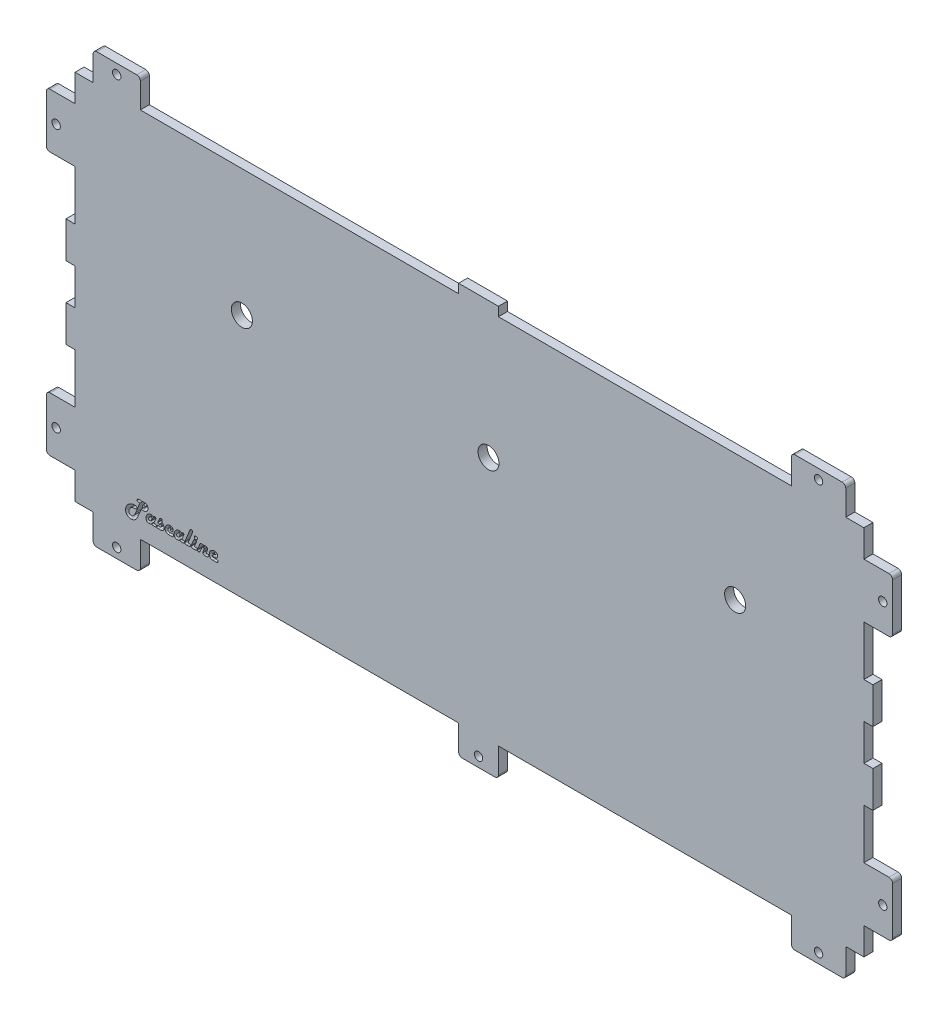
SolidWorks part; units mm, degrees
ref_plane "Front Plane" through (0, 0, 0) normal (0, 0, 1) x (1, 0, 0)
ref_plane "Top Plane" through (0, 0, 0) normal (0, 1, 0) x (1, 0, 0)
ref_plane "Right Plane" through (0, 0, 0) normal (1, 0, 0) x (0, 0, -1)
sketch "Sketch1" plane through (0, 0, 0) normal (0, 0, 1) x (1, 0, 0)
  line L0 (144.78, 85.725) -> (231.14, 85.725) construction
  line L1 (0, 0) -> (276.225, 0)
  line L2 (0, 0) -> (0, 130.175)
  line L3 (0, 130.175) -> (276.225, 130.175)
  line L4 (276.225, 0) -> (276.225, 130.175)
  line L6 (58.42, 85.725) -> (144.78, 85.725) construction
  circle A0 centre (58.42, 85.725) radius 3.683
  circle A1 centre (231.14, 85.725) radius 3.683
  circle A3 centre (144.78, 85.725) radius 3.683
  dimension "D3" = 7.366
  dimension "D1" = 130.175
  dimension "D2" = 45.085
  dimension "D4" = 276.225
  dimension "D5" = 85.725
  dimension "D6" = 86.36
extrude "Boss-Extrude1" add sketch "Sketch1" along normal blind 3.175
sketch "Sketch2" plane through (0, 0, 0) normal (0, 0, 1) x (1, 0, 0)
  line L1 (138.1125, 130.175) -> (138.1125, 0) construction
  line L2 (276.225, 130.175) -> (0, 130.175) construction
  line L3 (0, 0) -> (276.225, 0) construction
  line L4 (286.258, 9.525) -> (286.258, 28.575)
  line L6 (0, 130.175) -> (0, 0) construction
  line L7 (0, 65.0875) -> (276.225, 65.0875) construction
  line L8 (276.225, 0) -> (276.225, 130.175) construction
  line L9 (276.225, 120.65) -> (286.258, 120.65)
  line L10 (276.225, 120.65) -> (276.225, 101.6)
  line L11 (276.225, 101.6) -> (286.258, 101.6)
  line L12 (286.258, 120.65) -> (286.258, 101.6)
  line L13 (276.225, 28.575) -> (286.258, 28.575)
  line L15 (276.225, 9.525) -> (276.225, 28.575)
  line L16 (276.225, 9.525) -> (286.258, 9.525)
  line L17 (-3.175, 84.1375) -> (-3.175, 71.4375)
  line L18 (276.225, 84.1375) -> (279.4, 84.1375)
  line L19 (276.225, 84.1375) -> (276.225, 71.4375)
  line L20 (276.225, 71.4375) -> (279.4, 71.4375)
  line L21 (279.4, 84.1375) -> (279.4, 71.4375)
  line L22 (0, 71.4375) -> (-3.175, 71.4375)
  line L23 (0, 84.1375) -> (0, 71.4375)
  line L24 (0, 84.1375) -> (-3.175, 84.1375)
  line L25 (0, 9.525) -> (-10.033, 9.525)
  line L26 (0, 9.525) -> (0, 28.575)
  line L27 (0, 28.575) -> (-10.033, 28.575)
  line L29 (-10.033, 120.65) -> (-10.033, 101.6)
  line L30 (0, 101.6) -> (-10.033, 101.6)
  line L31 (0, 120.65) -> (0, 101.6)
  line L32 (0, 120.65) -> (-10.033, 120.65)
  line L33 (-10.033, 9.525) -> (-10.033, 28.575)
  line L34 (279.4, 46.0375) -> (279.4, 58.7375)
  line L35 (6.35, 0) -> (22.86, 0)
  line L36 (6.35, 0) -> (6.35, -10.033)
  line L37 (6.35, -10.033) -> (22.86, -10.033)
  line L38 (22.86, 0) -> (22.86, -10.033)
  line L39 (134.3025, 0) -> (148.2725, 0)
  line L40 (134.3025, 0) -> (134.3025, -10.033)
  line L41 (134.3025, -10.033) -> (148.2725, -10.033)
  line L42 (148.2725, 0) -> (148.2725, -10.033)
  line L43 (250.825, 0) -> (269.875, 0)
  line L44 (250.825, 0) -> (250.825, -10.033)
  line L45 (250.825, -10.033) -> (269.875, -10.033)
  line L46 (269.875, 0) -> (269.875, -10.033)
  line L47 (6.35, 130.175) -> (22.86, 130.175)
  line L48 (6.35, 130.175) -> (6.35, 140.208)
  line L49 (6.35, 140.208) -> (22.86, 140.208)
  line L50 (22.86, 130.175) -> (22.86, 140.208)
  line L51 (250.825, 130.175) -> (269.875, 130.175)
  line L52 (250.825, 130.175) -> (250.825, 140.208)
  line L53 (250.825, 140.208) -> (269.875, 140.208)
  line L54 (269.875, 130.175) -> (269.875, 140.208)
  line L55 (134.3025, 130.175) -> (148.2725, 130.175)
  line L56 (134.3025, 130.175) -> (134.3025, 133.35)
  line L57 (134.3025, 133.35) -> (148.2725, 133.35)
  line L58 (148.2725, 130.175) -> (148.2725, 133.35)
  line L59 (276.225, 58.7375) -> (279.4, 58.7375)
  line L60 (276.225, 46.0375) -> (276.225, 58.7375)
  line L61 (276.225, 46.0375) -> (279.4, 46.0375)
  line L62 (0, 46.0375) -> (-3.175, 46.0375)
  line L63 (0, 46.0375) -> (0, 58.7375)
  line L64 (0, 58.7375) -> (-3.175, 58.7375)
  line L65 (-3.175, 46.0375) -> (-3.175, 58.7375)
  point P62 (141.2875, -10.033)
  dimension "D1" = 19.05
  dimension "D2" = 10.033
  dimension "D3" = 9.525
  dimension "D4" = 10.033
  dimension "D5" = 6.35
  dimension "D6" = 6.35
  dimension "D7" = 3.175
  dimension "D8" = 16.51
  dimension "D9" = 13.97
  dimension "D10" = 19.05
  dimension "D11" = 10.033
  dimension "D12" = 3.175
  dimension "D13" = 3.175
  dimension "D14" = 12.7
  dimension "D15" = 6.35
extrude "Boss-Extrude2" add sketch "Sketch2" along normal blind 3.175
hole_wizard "#4 Clearance Hole1" positions "Sketch4" profile "Sketch3" hole size "#4" standard "ANSI Inch"
sketch "Sketch4" plane through (0, 0, 3.175) normal (0, 0, 1) x (1, 0, 0)
  line L0 (148.2725, 0) -> (250.825, 0) construction
  line L1 (134.3025, -10.033) -> (148.2725, -10.033) construction
  line L2 (6.35, -10.033) -> (22.86, -10.033) construction
  line L3 (250.825, -10.033) -> (269.875, -10.033) construction
  line L8 (276.225, 120.65) -> (276.225, 130.175) construction
  line L9 (286.258, 101.6) -> (286.258, 120.65) construction
  line L10 (138.1125, 111.125) -> (138.1125, 19.05) construction
  line L12 (0, 65.0875) -> (276.225, 65.0875) construction
  line L13 (0, 71.4375) -> (0, 58.7375) construction
  line L14 (276.225, 58.7375) -> (276.225, 71.4375) construction
  point P0 (14.605, -6.604)
  point P2 (141.2875, -6.604)
  point P4 (260.35, -6.604)
  point P11 (141.2875, -10.033)
  point P14 (14.605, -10.033)
  point P17 (260.35, -10.033)
  point P29 (282.829, 111.125)
  point P38 (286.258, 111.125)
  point P47 (-6.604, 111.125)
  point P49 (138.1125, 65.0875)
  point P64 (138.1125, 65.0875)
  point P67 (260.35, 136.779)
  point P68 (14.605, 136.779)
  point P70 (282.829, 19.05)
  point P71 (-6.604, 19.05)
  dimension "D1" = 6.604
  dimension "D2" = 6.604
sketch "Sketch3" plane through (14.605, -6.604, 3.175) normal (1, 0, 0) x (0, -1, 0)
  line L0 (0, 0) -> (0, 3.1751)
  line L1 (0, 3.1751) -> (1.4732, 3.1751)
  line L2 (1.4732, 3.1751) -> (1.4732, 0)
  line L5 (1.4732, 0) -> (0, 0)
  line L11 (0, -6.35) -> (0, 107.95) construction
  dimension "Thru Hole Dia." = 2.9464
  dimension "Thru Hole Depth" = 3.1751
fillet "Fillet1" radius 1.27 18 edges at (22.86, -10.033, 1.5875) (134.3025, -10.033, 1.5875) (148.2725, -10.033, 1.5875) (250.825, -10.033, 1.5875) (269.875, -10.033, 1.5875) (286.258, 9.525, 1.5875) (286.258, 28.575, 1.5875) (286.258, 101.6, 1.5875) (286.258, 120.65, 1.5875) (269.875, 140.208, 1.5875) (250.825, 140.208, 1.5875) (22.86, 140.208, 1.5875) (6.35, 140.208, 1.5875) (-10.033, 120.65, 1.5875) (-10.033, 101.6, 1.5875) (-10.033, 28.575, 1.5875) (-10.033, 9.525, 1.5875) (6.35, -10.033, 1.5875)
sketch "Sketch5" plane through (0, 0, 3.175) normal (0, 0, 1) x (1, 0, 0)
  text T0 "Pascaline" font "Harlow Solid Italic" height in points 18
  dimension "D1" = 6.35
  dimension "D2" = 17.78
extrude "Cut-Extrude1" cut sketch "Sketch5" against normal through all
